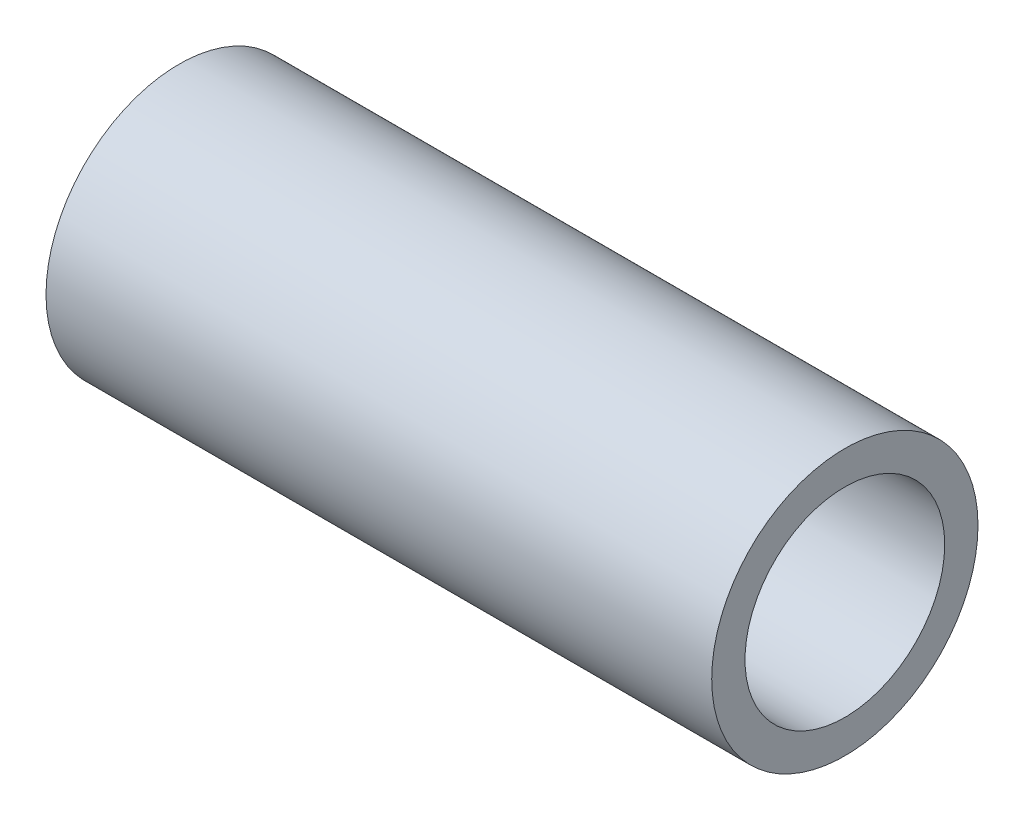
SolidWorks part; units mm, degrees
ref_plane "Front" through (0, 0, 0) normal (0, 0, 1) x (1, 0, 0)
ref_plane "Top" through (0, 0, 0) normal (0, 1, 0) x (1, 0, 0)
ref_plane "Right" through (0, 0, 0) normal (1, 0, 0) x (0, 0, -1)
sketch "Sketch1" plane through (0, 0, 0) normal (1, 0, 0) x (0, 0, -1)
  circle A0 centre (0, 0) radius 12
  circle A1 centre (0, 0) radius 9
  dimension "D1" = 18
  dimension "D2" = 24
extrude "Boss-Extrude1" add sketch "Sketch1" along normal mid plane 60
